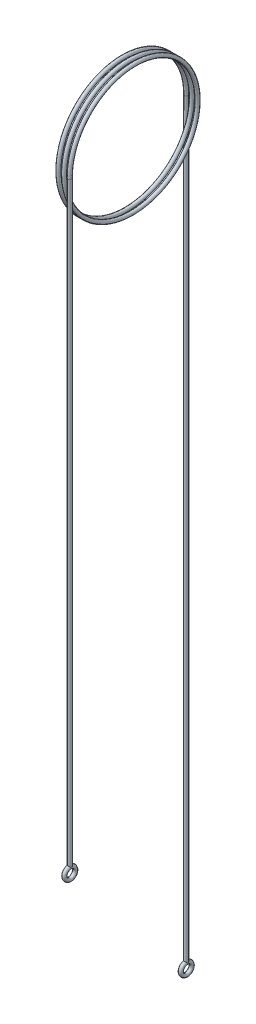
SolidWorks part; units mm, degrees
ref_plane "Спереди" through (0, 0, 0) normal (0, 0, 1) x (1, 0, 0)
ref_plane "Сверху" through (0, 0, 0) normal (0, 1, 0) x (1, 0, 0)
ref_plane "Справа" through (0, 0, 0) normal (1, 0, 0) x (0, 0, -1)
sketch "Эскиз1" plane through (0, 0, 0) normal (1, 0, 0) x (0, 0, -1)
  circle A0 centre (0, 0) radius 13.9
  dimension "D1" = 27.8
curve "Спираль1"
sketch "Эскиз2" plane through (0, 0, 0) normal (0, 1, 0) x (1, 0, 0)
  circle A0 centre (0, 13.9) radius 0.4
  dimension "D1" = 0.8
sweep "По траектории1" add profiles "Эскиз2" path "Спираль1"
sketch "Эскиз3" plane through (0, 0, 0) normal (0, 1, 0) x (1, 0, 0)
  circle A1 centre (0, 13.9) radius 0.4
  circle A2 centre (0, 13.9) radius 0.4
  dimension "D1" = 0
extrude "Бобышка-Вытянуть1" add sketch "Эскиз3" against normal blind 160
sketch "Эскиз4" plane through (0, 0, 0) normal (0, 1, 0) x (1, 0, 0)
  circle A1 centre (3, -13.9) radius 0.4
  circle A2 centre (3, -13.9) radius 0.4
  dimension "D1" = 0
extrude "Бобышка-Вытянуть2" add sketch "Эскиз4" against normal blind 127
sketch "Эскиз5" plane through (0, 0, 0) normal (1, 0, 0) x (0, 0, -1)
  line L0 (13.5, -160) -> (14.3, -160) construction
  line L1 (13.5, -160) -> (14.3, -160) construction
  line L2 (13.9, -161.15) -> (13.9, -160) construction
  circle A0 centre (13.9, -161.15) radius 1.15
  dimension "D1" = 2.3
ref_plane "Плоскость1" through (0, -161.15, 0) normal (0, 1, 0) x (-1, 0, 0)
sketch "Эскиз6" plane through (0, -161.15, 0) normal (0, 1, 0) x (-1, 0, 0)
  circle A0 centre (0, -12.75) radius 0.4
  dimension "D1" = 0.8
sweep "По траектории2" add profiles "Эскиз6" path "Эскиз5"
ref_plane "Плоскость2" through (3, 0, 0) normal (1, 0, 0) x (0, 0, -1)
sketch "Эскиз7" plane through (3, 0, 0) normal (1, 0, 0) x (0, 0, -1)
  line L0 (-14.3, -127) -> (-13.5, -127) construction
  line L1 (-14.3, -127) -> (-13.5, -127) construction
  line L2 (-13.9, -128.15) -> (-13.9, -127) construction
  circle A0 centre (-13.9, -128.15) radius 1.15
  dimension "D1" = 2.3
ref_plane "Плоскость3" through (0, -128.15, 0) normal (0, 1, 0) x (-1, 0, 0)
sketch "Эскиз8" plane through (0, -128.15, 0) normal (0, 1, 0) x (-1, 0, 0)
  circle A0 centre (-3, 15.05) radius 0.4
  dimension "D1" = 0.8
sweep "По траектории3" add profiles "Эскиз8" path "Эскиз7"
